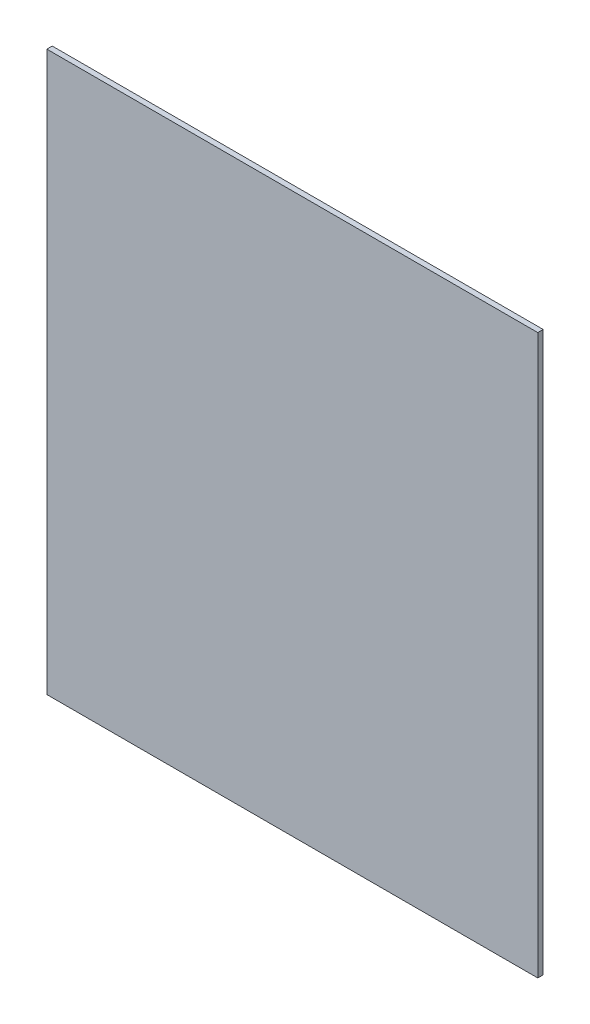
SolidWorks part; units mm, degrees
ref_plane "Plane1" through (0, 0, 0) normal (0, 0, 1) x (1, 0, 0)
ref_plane "Plane2" through (0, 0, 0) normal (0, 1, 0) x (1, 0, 0)
ref_plane "Plane3" through (0, 0, 0) normal (1, 0, 0) x (0, 0, -1)
ref_plane "Plane4" through (0, 0, 0) normal (0, 0, -1) x (-1, 0, 0)
sketch "Sketch1" plane through (0, 0, 0) normal (0, 0, -1) x (-1, 0, 0)
  line L0 (6.823, -7.768) -> (6.823, 7.768)
  line L1 (6.823, 7.768) -> (-6.823, 7.768)
  line L2 (-6.823, 7.768) -> (-6.823, -7.768)
  line L3 (-6.823, -7.768) -> (6.823, -7.768)
  line L4 (6.823, 7.768) -> (-6.823, -7.768) construction
  dimension "D1" = 13.646
  dimension "D2" = 15.536
extrude "Extrude1" add sketch "Sketch1" against normal blind 0.15
